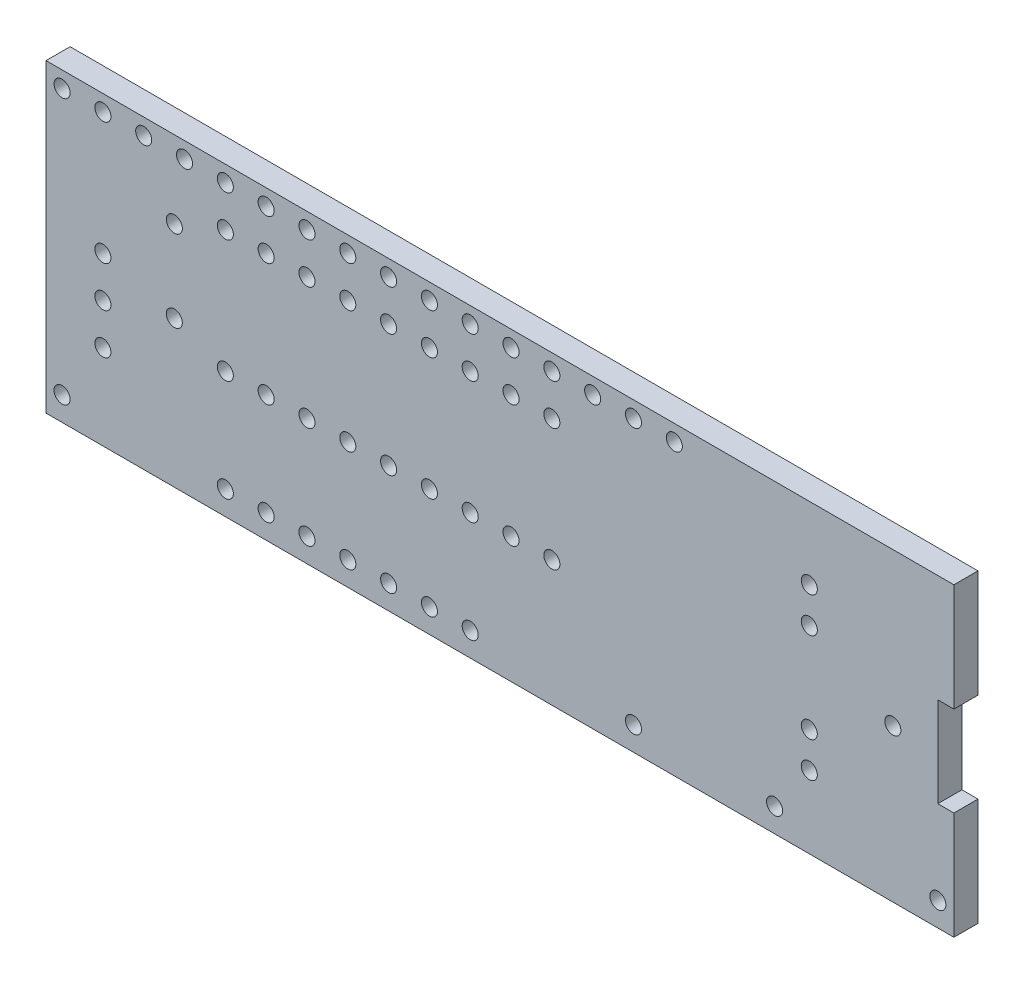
SolidWorks part; units mm, degrees
ref_plane "Plan de face" through (0, 0, 0) normal (0, 0, 1) x (1, 0, 0)
ref_plane "Plan de dessus" through (0, 0, 0) normal (0, 1, 0) x (1, 0, 0)
ref_plane "Plan de droite" through (0, 0, 0) normal (1, 0, 0) x (0, 0, -1)
sketch "Esquisse1" plane through (0, 0, 0) normal (0, 0, 1) x (1, 0, 0)
  line L0 (1, 21.5522) -> (1, 7.2078) construction
  line L1 (0, 0) -> (56.5, 0)
  line L2 (0, 0) -> (0, 19)
  line L3 (0, 19) -> (56.5, 19)
  line L4 (56.5, 0) -> (56.5, 6.7)
  line L5 (-2.27, 18) -> (1.851, 18) construction
  line L6 (28.25, -4.5115) -> (28.25, 2.3575) construction
  line L7 (60.3458, 9.5) -> (41.2766, 9.5) construction
  line L8 (55.5, 20.1074) -> (55.5, 5.0406) construction
  line L9 (60.3458, 12.3) -> (54.3278, 12.3) construction
  line L10 (56.5, 12.3) -> (55.5, 12.3)
  line L11 (56.5, 6.7) -> (55.5, 6.7)
  line L12 (55.5, 12.3) -> (55.5, 6.7)
  line L13 (56.5, 12.3) -> (56.5, 19)
  line L14 (52.7, 13.7293) -> (52.7, 8.5095) construction
  line L15 (47.5, 15.0163) -> (47.5, 8.5095) construction
  line L16 (46.8459, 12.3) -> (49.5053, 12.3) construction
  line L17 (46.8459, 14.5) -> (49.5053, 14.5) construction
  circle A0 centre (1, 18) radius 0.5
  circle A1 centre (3.54, 18) radius 0.5
  circle A2 centre (6.08, 18) radius 0.5
  circle A3 centre (8.62, 18) radius 0.5
  circle A4 centre (11.16, 18) radius 0.5
  circle A5 centre (13.7, 18) radius 0.5
  circle A6 centre (16.24, 18) radius 0.5
  circle A7 centre (18.78, 18) radius 0.5
  circle A8 centre (21.32, 18) radius 0.5
  circle A9 centre (23.86, 18) radius 0.5
  circle A10 centre (26.4, 18) radius 0.5
  circle A11 centre (28.94, 18) radius 0.5
  circle A12 centre (31.48, 18) radius 0.5
  circle A13 centre (34.02, 18) radius 0.5
  circle A14 centre (36.56, 18) radius 0.5
  circle A15 centre (39.1, 18) radius 0.5
  circle A16 centre (31.48, 15.46) radius 0.5
  circle A17 centre (28.94, 15.46) radius 0.5
  circle A18 centre (26.4, 15.46) radius 0.5
  circle A19 centre (23.86, 15.46) radius 0.5
  circle A20 centre (21.32, 15.46) radius 0.5
  circle A21 centre (18.78, 15.46) radius 0.5
  circle A22 centre (16.24, 15.46) radius 0.5
  circle A23 centre (13.7, 15.46) radius 0.5
  circle A24 centre (11.16, 15.46) radius 0.5
  circle A25 centre (31.48, 7.84) radius 0.5
  circle A26 centre (28.94, 7.84) radius 0.5
  circle A27 centre (26.4, 7.84) radius 0.5
  circle A28 centre (23.86, 7.84) radius 0.5
  circle A29 centre (21.32, 7.84) radius 0.5
  circle A30 centre (18.78, 7.84) radius 0.5
  circle A31 centre (16.24, 7.84) radius 0.5
  circle A32 centre (13.7, 7.84) radius 0.5
  circle A33 centre (11.16, 7.84) radius 0.5
  circle A34 centre (23.86, 1.49) radius 0.5
  circle A35 centre (21.32, 1.49) radius 0.5
  circle A36 centre (18.78, 1.49) radius 0.5
  circle A37 centre (16.24, 1.49) radius 0.5
  circle A38 centre (13.7, 1.49) radius 0.5
  circle A39 centre (11.16, 1.49) radius 0.5
  circle A40 centre (26.4, 1.49) radius 0.5
  circle A41 centre (36.56, 1.49) radius 0.5
  circle A42 centre (1, 1.49) radius 0.5
  circle A43 centre (55.5, 1.49) radius 0.5
  circle A44 centre (45.34, 1.49) radius 0.5
  circle A45 centre (3.54, 5.3) radius 0.5
  circle A46 centre (3.54, 7.84) radius 0.5
  circle A47 centre (3.54, 10.38) radius 0.5
  circle A48 centre (52.7, 9.5) radius 0.5
  circle A49 centre (47.5, 14.5) radius 0.5
  circle A50 centre (47.5, 12.3) radius 0.5
  circle A51 centre (47.5, 4.5) radius 0.5
  circle A52 centre (47.5, 6.7) radius 0.5
  circle A53 centre (7.985, 14.19) radius 0.5
  circle A54 centre (7.985, 9.11) radius 0.5
  dimension "D3" = 16
  dimension "D18" = 3.81
  dimension "D19" = 2
  dimension "D1" = 1
  dimension "D2" = 1
  dimension "D10" = 2
  dimension "D11" = 2.8
  dimension "D14" = 2.8
  dimension "D15" = 5.2
  dimension "D16" = 2.2
  dimension "D17" = 2.8
  dimension "D20" = 0.635
  dimension "D4" = 2
  dimension "D5" = 2
  dimension "D6" = 2
  dimension "D7" = 2
  dimension "D8" = 2
  dimension "D9" = 2
  dimension "D12" = 2
  dimension "D13" = 3
extrude "Boss.-Extru.1" add sketch "Esquisse1" along normal blind 1.5
